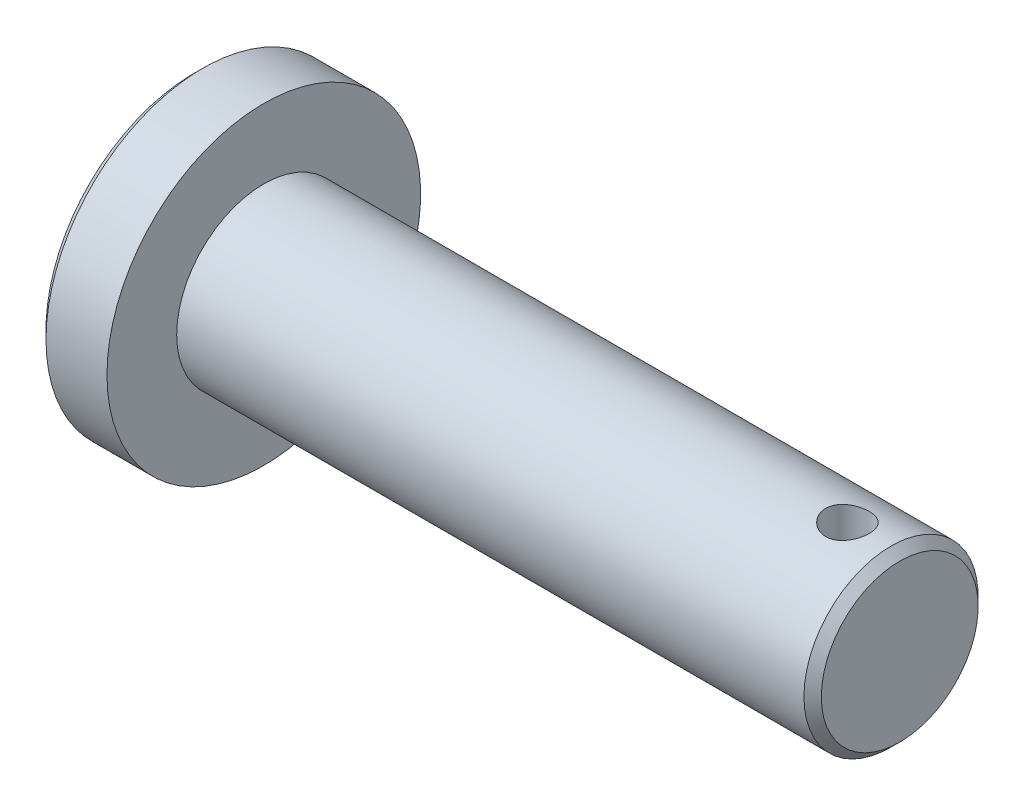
SolidWorks part; units mm, degrees
ref_plane "Plan de face" through (0, 0, 0) normal (0, 0, 1) x (1, 0, 0)
ref_plane "Plan de dessus" through (0, 0, 0) normal (0, 1, 0) x (1, 0, 0)
ref_plane "Plan de droite" through (0, 0, 0) normal (1, 0, 0) x (0, 0, -1)
sketch "Esquisse1" plane through (0, 0, 0) normal (0, 0, 1) x (1, 0, 0)
  line L0 (-47.0053, 0) -> (76.397, 0) construction
  line L1 (0, 0) -> (0, 18)
  line L2 (0, 18) -> (8, 18)
  line L3 (8, 18) -> (8, 10)
  line L4 (8, 10) -> (81, 10)
  line L5 (81, 10) -> (81, 0)
  line L6 (0, 0) -> (81, 0)
  dimension "D1" = 8
  dimension "D2" = 81
  dimension "D3" = 18
  dimension "D4" = 10
revolve "Révolution1" add sketch "Esquisse1" angle 360 about L0
sketch "Esquisse2" plane through (0, 0, 0) normal (0, 1, 0) x (1, 0, 0)
  line L0 (8, -18) -> (8, 18) construction
  line L1 (-47.0053, 0) -> (76.397, 0) construction
  circle A0 centre (75, 0) radius 2.5
  dimension "D1" = 5
  dimension "D2" = 67
extrude "Enlèv. mat.-Extru.1" cut sketch "Esquisse2" against normal through all and the other way through all
chamfer "Chanfrein1" distance 1 angle 45 2 edges at (81, 0, 10) (0, 0, 18)
